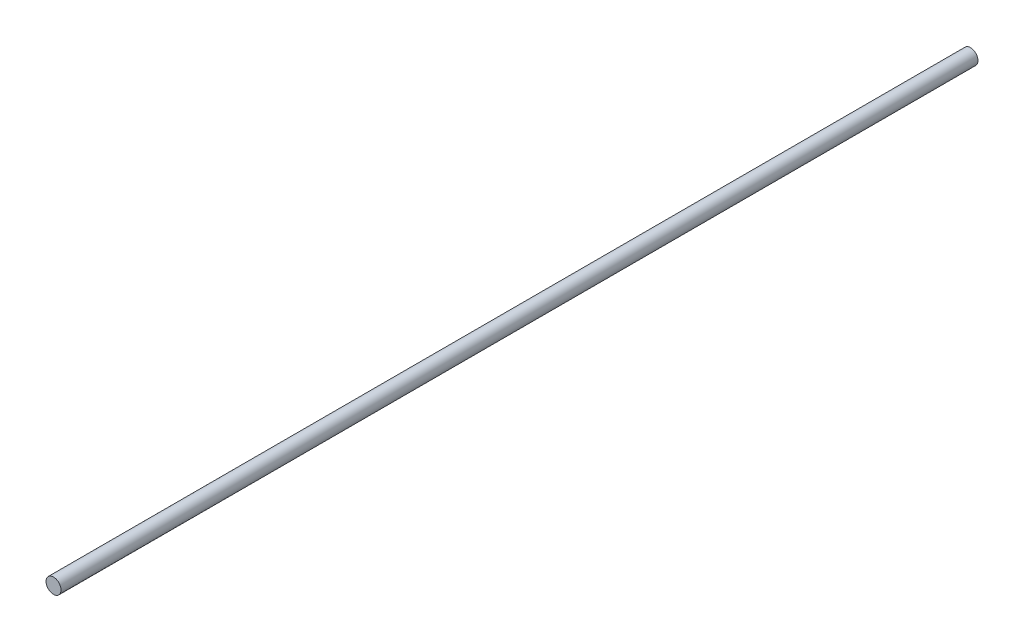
SolidWorks part; units mm, degrees
ref_plane "Front Plane" through (0, 0, 0) normal (0, 0, 1) x (1, 0, 0)
ref_plane "Top Plane" through (0, 0, 0) normal (0, 1, 0) x (1, 0, 0)
ref_plane "Right Plane" through (0, 0, 0) normal (1, 0, 0) x (0, 0, -1)
sketch "Sketch1" plane through (0, 0, 0) normal (0, 0, 1) x (1, 0, 0)
  circle A0 centre (0, 0) radius 6.35
  dimension "D1" = 12.7
extrude "Extrude1" add sketch "Sketch1" along normal blind 774.7
